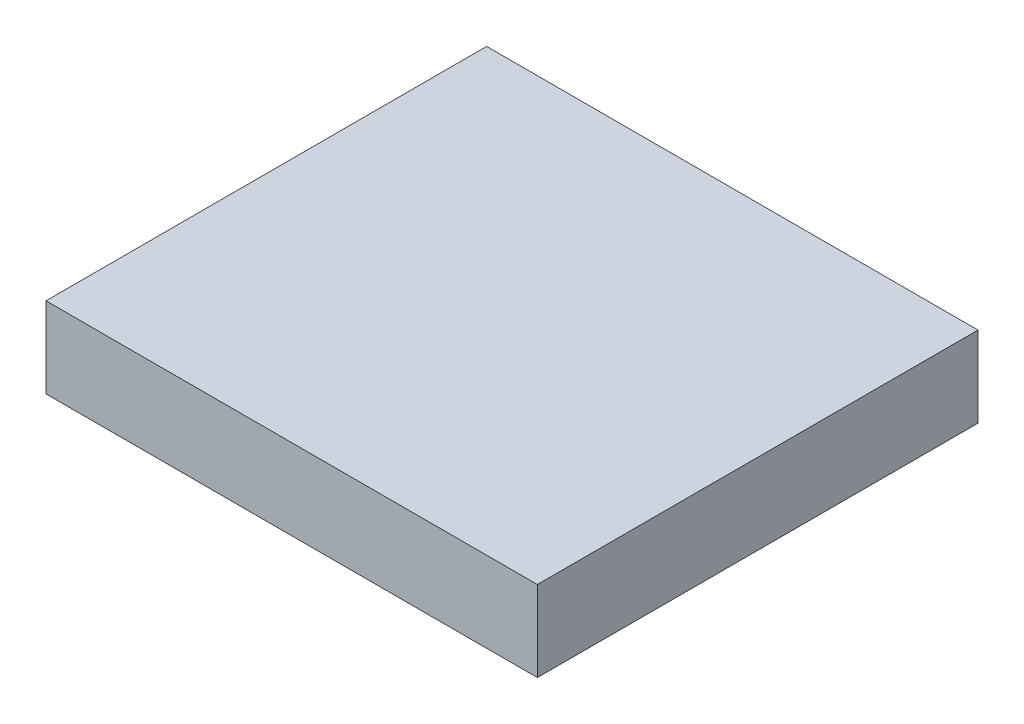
SolidWorks part; units mm, degrees
ref_plane "Front" through (0, 0, 0) normal (0, 0, 1) x (1, 0, 0)
ref_plane "Top" through (0, 0, 0) normal (0, 1, 0) x (1, 0, 0)
ref_plane "Right" through (0, 0, 0) normal (1, 0, 0) x (0, 0, -1)
sketch "Sketch1" plane through (0, 0, 0) normal (0, 0, 1) x (1, 0, 0)
  line L1 (0, 0) -> (226.5899, 0)
  line L2 (0, 0) -> (0, 37.1789)
  line L3 (0, 37.1789) -> (226.5899, 37.1789)
  line L4 (226.5899, 0) -> (226.5899, 37.1789)
extrude "Extrude2" add sketch "Sketch1" along normal blind 203.2
